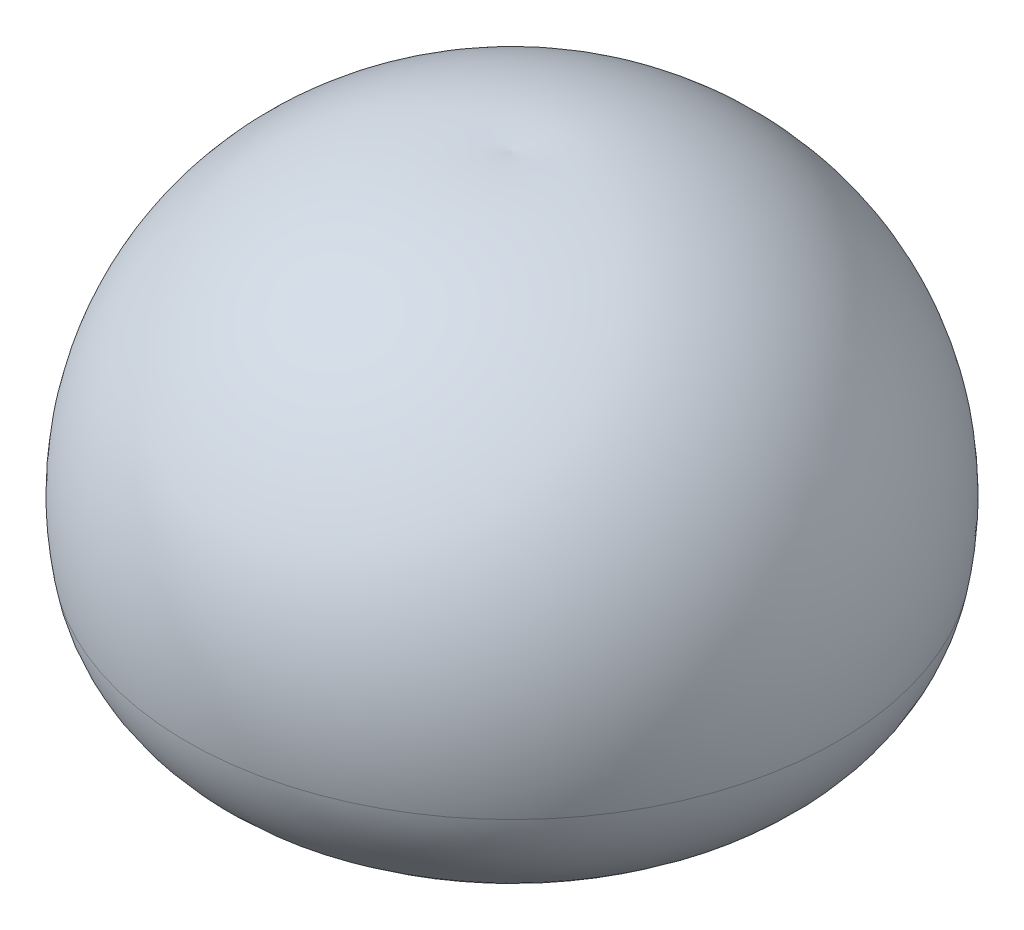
SolidWorks part; units mm, degrees
ref_plane "前视基准面" through (0, 0, 0) normal (0, 0, 1) x (1, 0, 0)
ref_plane "上视基准面" through (0, 0, 0) normal (0, 1, 0) x (1, 0, 0)
ref_plane "右视基准面" through (0, 0, 0) normal (1, 0, 0) x (0, 0, -1)
sketch "草图1" plane through (0, 0, 0) normal (0, 0, 1) x (1, 0, 0)
  line L0 (0, 3713.0807) -> (0, -1285.8886) construction
  line L14 (0, 3044.928) -> (0, 1312.7953)
  arc A0 (2663.4809, 181.4382) -> (0, 3044.928) centre (250, 607) ccw
  arc A1 (159.4699, 94.3407) -> (159.7306, 1119.7053) centre (250, 607) ccw
  arc A7 (159.4699, 94.3407) -> (2663.4809, 181.4382) centre (1402.2251, 403.8316) ccw
  arc A8 (159.7306, 1119.7053) -> (0, 1312.7953) centre (-902.2251, 403.8316) ccw
revolve "旋转1" add sketch "草图1" angle 360 about L0
